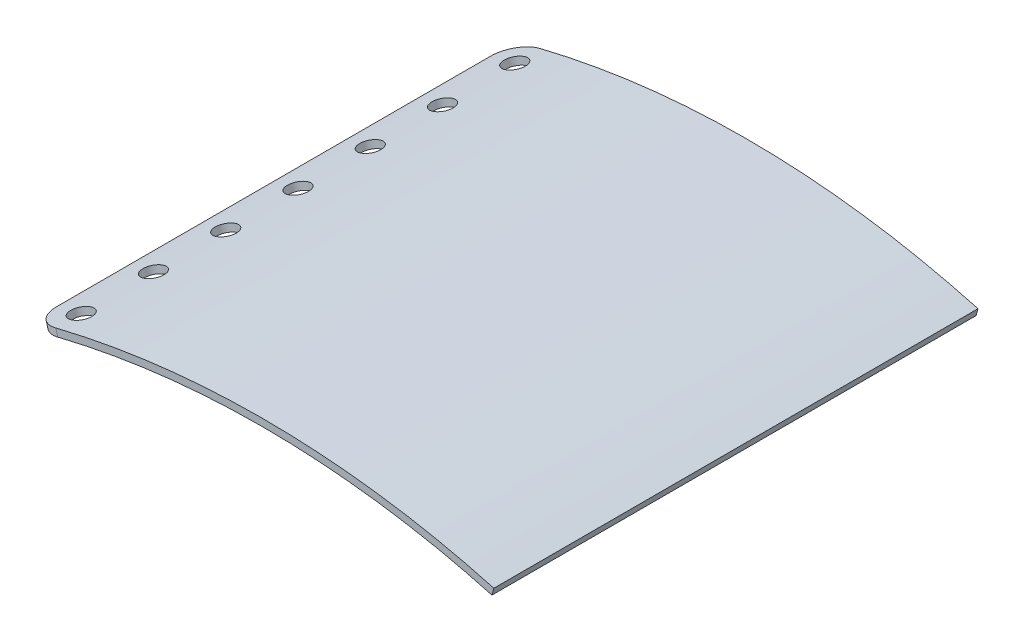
SolidWorks part; units mm, degrees
ref_plane "Plan de face" through (0, 0, 0) normal (0, 0, 1) x (1, 0, 0)
ref_plane "Plan de dessus" through (0, 0, 0) normal (0, 1, 0) x (1, 0, 0)
ref_plane "Plan de droite" through (0, 0, 0) normal (1, 0, 0) x (0, 0, -1)
sketch "Esquisse1" plane through (0, 0, 0) normal (0, 0, 1) x (1, 0, 0)
  arc A0 (0, 0) -> (64, 0) centre (32, -115.6547) cw
  point P3 (0, 0)
  dimension "D2" = 120
  dimension "D1" = 64
extrude "Extru.-Mince1" add sketch "Esquisse1" along normal blind 67 thin
hole_wizard "Diamètre du perçage Ø3.0 (3)2" positions "Esquisse3D2" profile "Esquisse3" hole size "Ø3.0" standard "Ansi Metric"
sketch3d "Esquisse3D2"
  line L6 (0, 0, 67) -> (0, 0, 0) construction
  line L7 (3.3865, 0.884, 3.5) -> (3.3865, 0.884, 0) construction
  arc A0 (0, 0, 0) -> (64, 0, 0) centre (32, -115.6547, 0) ccw construction
  point P24 (3.3865, 0.884, 3.5)
  point P63 (32, -115.6547, -120)
  point P67 (0, 0, 0)
  dimension "D1" = 3.5
  dimension "D2" = 3.5
sketch "Esquisse3" plane through (3.3865, 0.884, 3.5) normal (0, 0, 1) x (-0.9712, -0.2384, 0)
  line L0 (0, 0) -> (0, 110.1213)
  line L1 (0, 110.1213) -> (1.5, 109.22)
  line L2 (1.5, 109.22) -> (1.5, 0)
  line L5 (1.5, 0) -> (0, 0)
  line L10 (0, 110.1213) -> (-1.5, 109.22) construction
  line L11 (0, -6.35) -> (0, 107.95) construction
  dimension "Diamètre du perçage" = 3
  dimension "Profondeur du perçage" = 109.22
  dimension "Angle de pointe" = 118
pattern_linear "Répétition linéaire1" count 7 spacing 10 along (0, 0, 1) of "Diamètre du perçage Ø3.0 (3)2"
fillet "Congé1" radius 3.5 2 edges at (0.1333, -0.4819, 67) (0.1333, -0.4819, 0)
